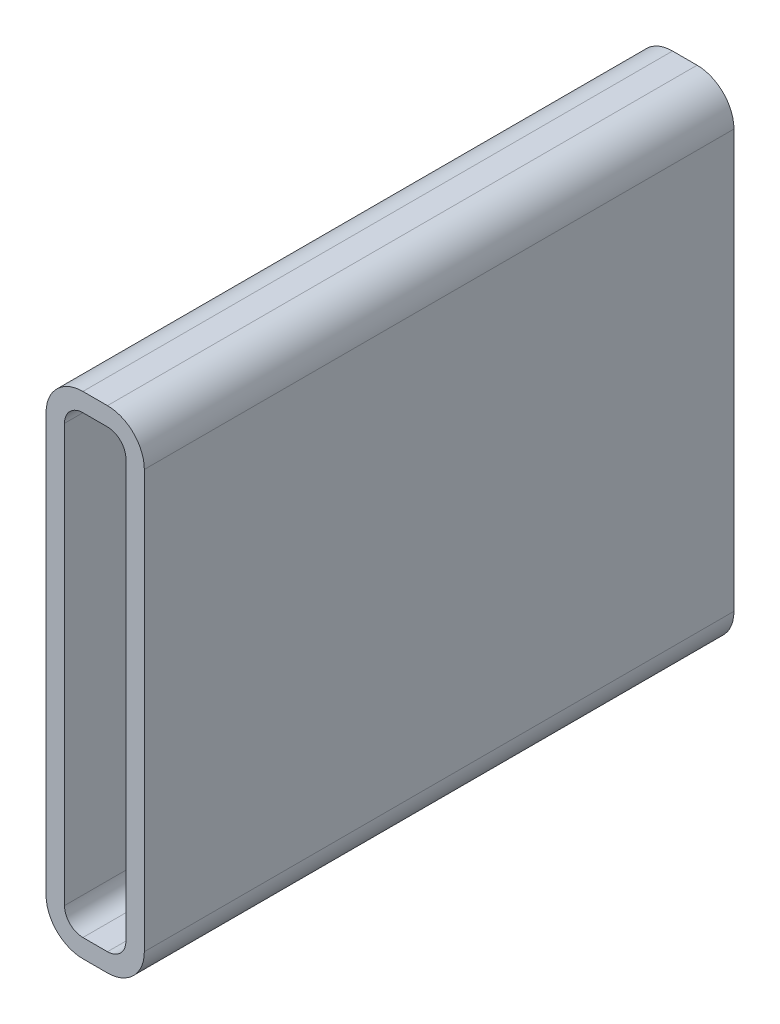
SolidWorks part; units mm, degrees
ref_plane "Front Plane" through (0, 0, 0) normal (0, 0, 1) x (1, 0, 0)
ref_plane "Top Plane" through (0, 0, 0) normal (0, 1, 0) x (1, 0, 0)
ref_plane "Right Plane" through (0, 0, 0) normal (1, 0, 0) x (0, 0, -1)
sketch "Sketch1" plane through (0, 0, 0) normal (0, 0, 1) x (1, 0, 0)
  line B0 (19.05, 254) -> (31.75, 254)
  arc B1 (50.8, 234.95) -> (31.75, 254) centre (31.75, 234.95) ccw
  line B2 (50.8, 234.95) -> (50.8, 19.05)
  arc B3 (31.75, 0) -> (50.8, 19.05) centre (31.75, 19.05) ccw
  line B4 (31.75, 0) -> (19.05, 0)
  arc B5 (0, 19.05) -> (19.05, 0) centre (19.05, 19.05) ccw
  line B6 (0, 19.05) -> (0, 234.95)
  arc B7 (19.05, 254) -> (0, 234.95) centre (19.05, 234.95) ccw
  line B8 (19.05, 244.475) -> (31.75, 244.475)
  arc B9 (41.275, 234.95) -> (31.75, 244.475) centre (31.75, 234.95) ccw
  line B10 (41.275, 234.95) -> (41.275, 19.05)
  arc B11 (31.75, 9.525) -> (41.275, 19.05) centre (31.75, 19.05) ccw
  line B12 (31.75, 9.525) -> (19.05, 9.525)
  arc B13 (9.525, 19.05) -> (19.05, 9.525) centre (19.05, 19.05) ccw
  line B14 (9.525, 19.05) -> (9.525, 234.95)
  arc B15 (19.05, 244.475) -> (9.525, 234.95) centre (19.05, 234.95) ccw
sketch_block_instance "HSS10x2x0.375-1"
sketch_block "HSS10x2x0.375"
extrude "Boss-Extrude1" add sketch "Sketch1" along normal blind 304.8
